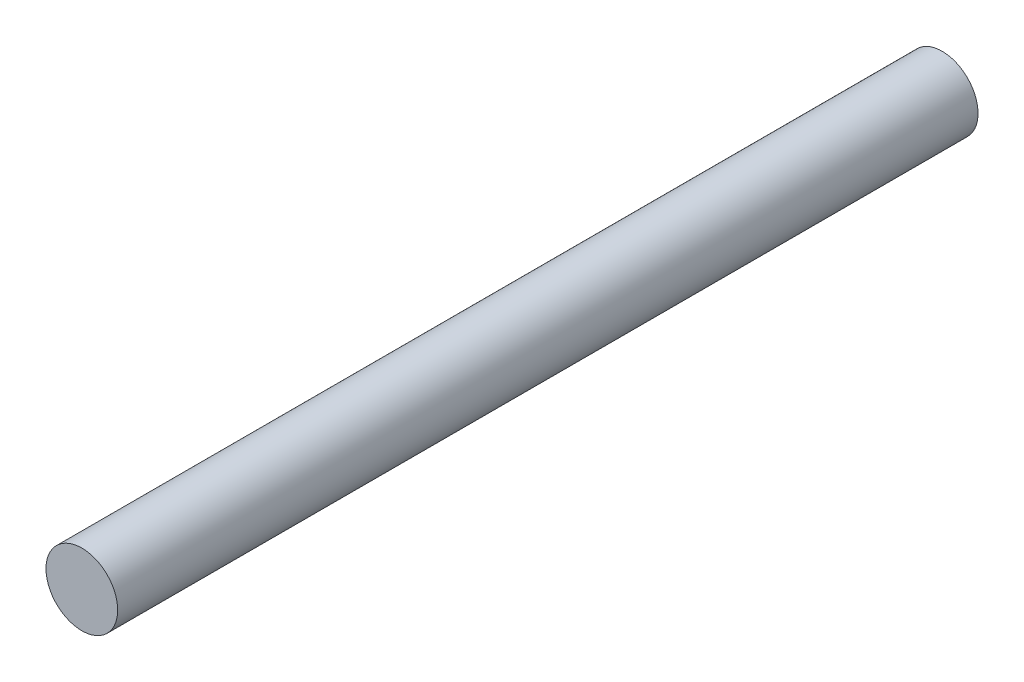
SolidWorks part; units mm, degrees
ref_plane "Plane1" through (0, 0, 0) normal (0, 0, 1) x (1, 0, 0)
ref_plane "Plane2" through (0, 0, 0) normal (0, 1, 0) x (1, 0, 0)
ref_plane "Plane3" through (0, 0, 0) normal (1, 0, 0) x (0, 0, -1)
sketch "Sketch1" plane through (0, 0, 0) normal (0, 0, 1) x (1, 0, 0)
  circle A0 centre (0, 0) radius 6.35
extrude "Base-Extrude" add sketch "Sketch1" along normal blind 152.4
